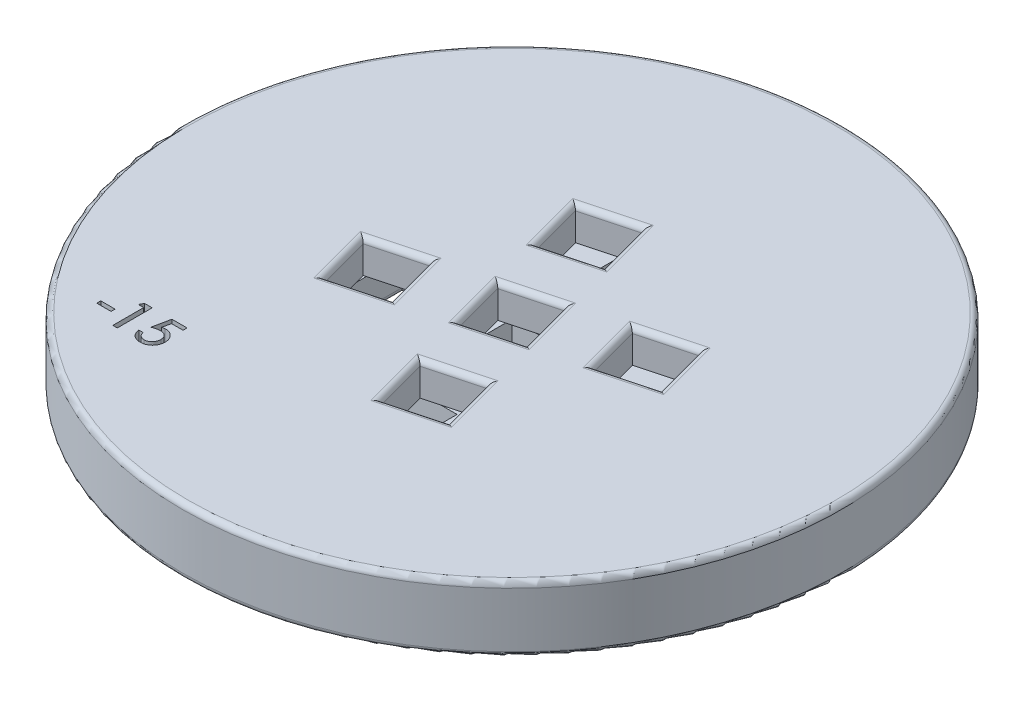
SolidWorks part; units mm, degrees
ref_plane "Front Plane" through (0, 0, 0) normal (0, 0, 1) x (1, 0, 0)
ref_plane "Top Plane" through (0, 0, 0) normal (0, 1, 0) x (1, 0, 0)
ref_plane "Right Plane" through (0, 0, 0) normal (1, 0, 0) x (0, 0, -1)
sketch "Sketch1" plane through (0, 0, 0) normal (0, 1, 0) x (1, 0, 0)
  circle A0 centre (0, 0) radius 30
extrude "Boss-Extrude1" add sketch "Sketch1" along normal blind 6
sketch "Sketch2" plane through (0, 6, 0) normal (0, 1, 0) x (1, 0, 0)
  line L0 (0, 0) -> (0, -10) construction
  line L1 (0, 0) -> (10, 0) construction
  line L2 (0, 0) -> (-10, 0) construction
  line L3 (0, 0) -> (0, 10) construction
  line L5 (-2.5, -7.5) -> (2.5, -7.5)
  line L6 (-2.5, -7.5) -> (-2.5, -12.5)
  line L7 (-2.5, -12.5) -> (2.5, -12.5)
  line L8 (2.5, -7.5) -> (2.5, -12.5)
  line L9 (-2.5, -7.5) -> (2.5, -12.5) construction
  line L10 (-2.5, -12.5) -> (2.5, -7.5) construction
  line L11 (-7.5, -2.5) -> (-12.5, -2.5)
  line L12 (-7.5, -2.5) -> (-7.5, 2.5)
  line L13 (-7.5, 2.5) -> (-12.5, 2.5)
  line L14 (-12.5, -2.5) -> (-12.5, 2.5)
  line L15 (-7.5, -2.5) -> (-12.5, 2.5) construction
  line L16 (-7.5, 2.5) -> (-12.5, -2.5) construction
  line L17 (2.5, -2.5) -> (-2.5, -2.5)
  line L18 (2.5, -2.5) -> (2.5, 2.5)
  line L19 (2.5, 2.5) -> (-2.5, 2.5)
  line L20 (-2.5, -2.5) -> (-2.5, 2.5)
  line L21 (2.5, -2.5) -> (-2.5, 2.5) construction
  line L22 (2.5, 2.5) -> (-2.5, -2.5) construction
  line L23 (-2.5, 12.5) -> (2.5, 12.5)
  line L24 (-2.5, 12.5) -> (-2.5, 7.5)
  line L25 (-2.5, 7.5) -> (2.5, 7.5)
  line L26 (2.5, 12.5) -> (2.5, 7.5)
  line L27 (-2.5, 12.5) -> (2.5, 7.5) construction
  line L28 (-2.5, 7.5) -> (2.5, 12.5) construction
  line L29 (12.5, -2.5) -> (7.5, -2.5)
  line L30 (12.5, -2.5) -> (12.5, 2.5)
  line L31 (12.5, 2.5) -> (7.5, 2.5)
  line L32 (7.5, -2.5) -> (7.5, 2.5)
  line L33 (12.5, -2.5) -> (7.5, 2.5) construction
  line L34 (12.5, 2.5) -> (7.5, -2.5) construction
  dimension "D1" = 5
  dimension "D2" = 10
  dimension "D3" = 5
  dimension "D4" = 5
  dimension "D5" = 5
  dimension "D6" = 5
  dimension "D7" = 5
  dimension "D8" = 5
sketch "Sketch3" plane through (0, 6, 0) normal (0, 1, 0) x (1, 0, 0)
sketch "Sketch4" plane through (0, 0, 0) normal (0, -1, 0) x (-1, 0, 0)
  line L0 (0, 0) -> (-10, 0) construction
  line L1 (0, 0) -> (0, -10) construction
  line L2 (0, 0) -> (0, 10) construction
  line L3 (0, 0) -> (10, 0) construction
  line L5 (-2.5, 2.5) -> (2.5, 2.5)
  line L6 (-2.5, 2.5) -> (-2.5, -2.5)
  line L7 (-2.5, -2.5) -> (2.5, -2.5)
  line L8 (2.5, 2.5) -> (2.5, -2.5)
  line L9 (-2.5, 2.5) -> (2.5, -2.5) construction
  line L10 (-2.5, -2.5) -> (2.5, 2.5) construction
  line L11 (-2.5, -7.5) -> (2.5, -7.5)
  line L12 (-2.5, -7.5) -> (-2.5, -12.5)
  line L13 (-2.5, -12.5) -> (2.5, -12.5)
  line L14 (2.5, -7.5) -> (2.5, -12.5)
  line L15 (-2.5, -7.5) -> (2.5, -12.5) construction
  line L16 (-2.5, -12.5) -> (2.5, -7.5) construction
  line L17 (7.5, 2.5) -> (12.5, 2.5)
  line L18 (7.5, 2.5) -> (7.5, -2.5)
  line L19 (7.5, -2.5) -> (12.5, -2.5)
  line L20 (12.5, 2.5) -> (12.5, -2.5)
  line L21 (7.5, 2.5) -> (12.5, -2.5) construction
  line L22 (7.5, -2.5) -> (12.5, 2.5) construction
  line L23 (-12.5, 2.5) -> (-7.5, 2.5)
  line L24 (-12.5, 2.5) -> (-12.5, -2.5)
  line L25 (-12.5, -2.5) -> (-7.5, -2.5)
  line L26 (-7.5, 2.5) -> (-7.5, -2.5)
  line L27 (-12.5, 2.5) -> (-7.5, -2.5) construction
  line L28 (-12.5, -2.5) -> (-7.5, 2.5) construction
  line L29 (2.5, 7.5) -> (-2.5, 7.5)
  line L30 (2.5, 7.5) -> (2.5, 12.5)
  line L31 (2.5, 12.5) -> (-2.5, 12.5)
  line L32 (-2.5, 7.5) -> (-2.5, 12.5)
  line L33 (2.5, 7.5) -> (-2.5, 12.5) construction
  line L34 (2.5, 12.5) -> (-2.5, 7.5) construction
  dimension "D1" = 5
  dimension "D2" = 5
  dimension "D3" = 5
  dimension "D4" = 5
  dimension "D5" = 5
  dimension "D6" = 5
extrude "Cut-Extrude2" cut sketch "Sketch4" against normal blind 3
fillet "Fillet2" radius 0.5 21 edges at (0, 0, 30) (2.5, 0, 0) (0, 0, 2.5) (-2.5, 0, 0) (0, 0, -2.5) (2.5, 0, 10) (0, 0, 12.5) (-2.5, 0, 10) (0, 0, 7.5) (-7.5, 0, 0) (-10, 0, 2.5) (-12.5, 0, 0) (-10, 0, -2.5) (12.5, 0, 0) (10, 0, 2.5) (7.5, 0, 0) (10, 0, -2.5) (-2.5, 0, -10) (0, 0, -12.5) (2.5, 0, -10) (0, 0, -7.5)
fillet "Fillet3" radius 0.5 1 edges at (0, 6, 30)
sketch "Sketch5" plane through (0, 6, 0) normal (0, 1, 0) x (1, 0, 0)
sketch "Sketch6" plane through (0, 6, 0) normal (0, 1, 0) x (1, 0, 0)
  line L0 (0, -30) -> (0, 30) construction
  line L1 (0, 0) -> (-7.7646, 28.9778) construction
  line L2 (-1.7678, -3.0619) -> (3.0619, -1.7678)
  line L3 (-1.7678, -3.0619) -> (-3.0619, 1.7678)
  line L4 (3.0619, -1.7678) -> (1.7678, 3.0619)
  line L5 (-3.0619, 1.7678) -> (1.7678, 3.0619)
  line L6 (-1.7678, -3.0619) -> (1.7678, 3.0619) construction
  line L7 (3.0619, -1.7678) -> (-3.0619, 1.7678) construction
  line L8 (-4.356, 6.5974) -> (0.4737, 7.8915)
  line L9 (-4.356, 6.5974) -> (-5.6501, 11.427)
  line L10 (0.4737, 7.8915) -> (-0.8204, 12.7211)
  line L11 (-5.6501, 11.427) -> (-0.8204, 12.7211)
  line L12 (-4.356, 6.5974) -> (-0.8204, 12.7211) construction
  line L13 (0.4737, 7.8915) -> (-5.6501, 11.427) construction
  line L14 (0, 0) -> (7.6352, -28.4948) construction
  line L15 (5.6501, -11.427) -> (0.8204, -12.7211)
  line L16 (5.6501, -11.427) -> (4.356, -6.5974)
  line L17 (0.8204, -12.7211) -> (-0.4737, -7.8915)
  line L18 (4.356, -6.5974) -> (-0.4737, -7.8915)
  line L19 (5.6501, -11.427) -> (-0.4737, -7.8915) construction
  line L20 (0.8204, -12.7211) -> (4.356, -6.5974) construction
  line L21 (0, 0) -> (-28.4948, -7.6352) construction
  line L22 (0, 0) -> (28.4948, 7.6352) construction
  line L23 (12.7211, 0.8204) -> (7.8915, -0.4737)
  line L24 (12.7211, 0.8204) -> (11.427, 5.6501)
  line L25 (7.8915, -0.4737) -> (6.5974, 4.356)
  line L26 (11.427, 5.6501) -> (6.5974, 4.356)
  line L27 (12.7211, 0.8204) -> (6.5974, 4.356) construction
  line L28 (7.8915, -0.4737) -> (11.427, 5.6501) construction
  line L29 (-11.427, -5.6501) -> (-6.5974, -4.356)
  line L30 (-11.427, -5.6501) -> (-12.7211, -0.8204)
  line L31 (-6.5974, -4.356) -> (-7.8915, 0.4737)
  line L32 (-12.7211, -0.8204) -> (-7.8915, 0.4737)
  line L33 (-11.427, -5.6501) -> (-7.8915, 0.4737) construction
  line L34 (-6.5974, -4.356) -> (-12.7211, -0.8204) construction
  line L35 (-19.7925, -19.1465) -> (-12.6703, -19.1465) construction
  circle A0 centre (0, 0) radius 30 construction
  circle A1 centre (0, 0) radius 29.5 construction
  text T0 "<b>-15</b>"
  point P8 (-2.5882, 9.6593)
  point P21 (2.5882, -9.6593)
  point P23 (9.6593, 2.5882)
  point P28 (-9.6593, -2.5882)
  dimension "D1" = 15
  dimension "D2" = 5
  dimension "D3" = 5
  dimension "D4" = 10
  dimension "D5" = 5
  dimension "D6" = 5
  dimension "D7" = 15
  dimension "D8" = 5
  dimension "D9" = 5
  dimension "D10" = 90
  dimension "D11" = 90
  dimension "D12" = 10
  dimension "D13" = 5
  dimension "D14" = 5
  dimension "D15" = 180
  dimension "D16" = 5
  dimension "D17" = 5
  dimension "D18" = 180
  dimension "D19" = 10
  dimension "D20" = 10
extrude "Cut-Extrude3" cut sketch "Sketch6" against normal blind 3
fillet "Fillet5" radius 0.5 20 edges at (10.3063, 6, -0.1734) (12.0741, 6, -3.2352) (7.2444, 6, -1.9411) (9.0122, 6, -5.003) (-1.9411, 6, -7.2444) (-0.1734, 6, -10.3063) (-3.2352, 6, -12.0741) (-5.003, 6, -9.0122) (0.647, 6, 2.4148) (-2.4148, 6, 0.647) (-0.647, 6, -2.4148) (2.4148, 6, -0.647) (3.2352, 6, 12.0741) (5.003, 6, 9.0122) (1.9411, 6, 7.2444) (0.1734, 6, 10.3063) (-9.0122, 6, 5.003) (-7.2444, 6, 1.9411) (-10.3063, 6, 0.1734) (-12.0741, 6, 3.2352)
